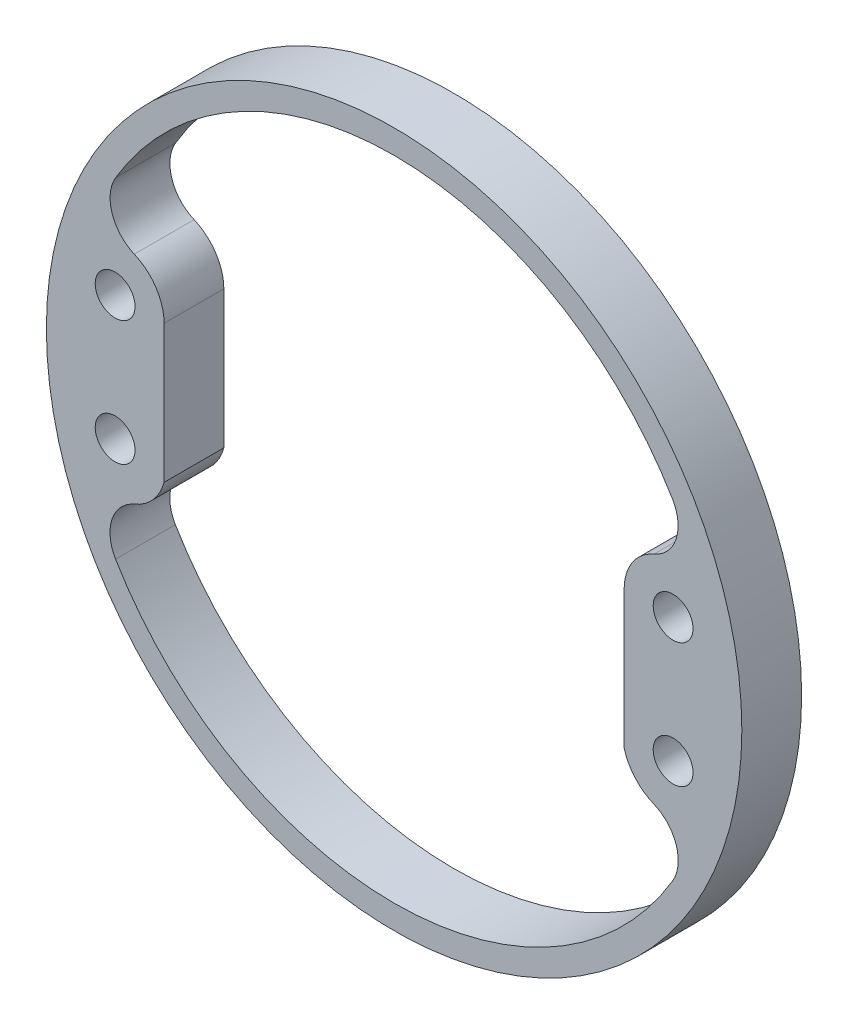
SolidWorks part; units mm, degrees
ref_plane "Front Plane" through (0, 0, 0) normal (0, 0, 1) x (1, 0, 0)
ref_plane "Top Plane" through (0, 0, 0) normal (0, 1, 0) x (1, 0, 0)
ref_plane "Right Plane" through (0, 0, 0) normal (1, 0, 0) x (0, 0, -1)
sketch "Sketch1" plane through (0, 0, 0) normal (0, 0, 1) x (1, 0, 0)
  line L0 (-14.6606, 4.036) -> (-14.6606, -0.7937)
  line L1 (14.6606, 4.036) -> (14.6606, -2.3686)
  line L2 (-5.8162, 0) -> (6.0586, 0) construction
  line L4 (14.6606, -0.7937) -> (14.6606, -4.7434)
  line L5 (0, 20.0235) -> (0, -16.7772) construction
  line L7 (-14.6606, -0.7937) -> (-14.6606, -4.7434)
  circle A0 centre (0, 0) radius 22.1615
  circle A1 centre (-17.78, 4.036) radius 1.27
  circle A2 centre (17.78, 4.036) radius 1.27
  arc A3 (-19.5527, 6.6028) -> (-14.6606, 4.036) centre (-17.78, 4.036) cw
  arc A4 (-19.5527, -6.6028) -> (-14.6606, -4.7434) centre (-17.78, -3.9015) ccw
  arc A5 (-19.5527, 6.6028) -> (19.5527, 6.6028) centre (0, 0) cw
  arc A6 (19.5527, -6.6028) -> (14.6606, -4.7434) centre (17.78, -3.9015) cw
  arc A7 (19.5527, 6.6028) -> (14.6606, 4.036) centre (17.78, 4.036) ccw
  arc A8 (-19.5527, -6.6028) -> (19.5527, -6.6028) centre (0, 0) ccw
  circle A9 centre (17.78, -3.9015) radius 1.27
  circle A10 centre (-17.78, -3.9015) radius 1.27
  dimension "D8" = 44.323
  dimension "D4" = 2.54
  dimension "D5" = 2.54
  dimension "D11" = 20.6375
  dimension "D6" = 17.78
  dimension "D7" = 7.9375
extrude "Extrude2" add sketch "Sketch1" along normal blind 3.81 contours A0 A9 A8 A4 L7 L0 A3 A5 A7 L1 L4 A6 A2 A1 A10
fillet "Fillet2" radius 2.54 4 edges at (19.5527, 6.6028, 1.905) (19.5527, -6.6028, 1.905) (-19.5527, -6.6028, 1.905) (-19.5527, 6.6028, 1.905)
